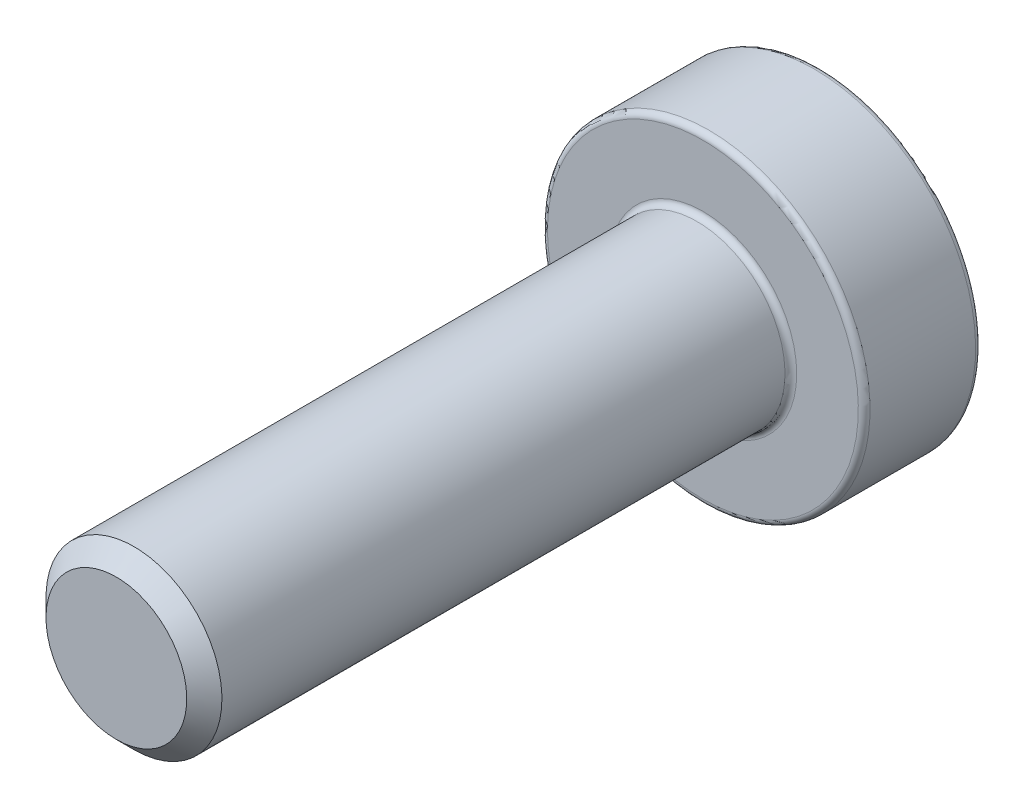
SolidWorks part; units mm, degrees
ref_plane "Plan1" through (0, 0, 0) normal (0, 0, 1) x (1, 0, 0)
ref_plane "Plan2" through (0, 0, 0) normal (0, 1, 0) x (1, 0, 0)
ref_plane "Plan3" through (0, 0, 0) normal (1, 0, 0) x (0, 0, -1)
sketch "Sketch1" plane through (0, 0, 0) normal (1, 0, 0) x (0, 0, -1)
  line L0 (2, 0) -> (-10, 0) construction
  line L1 (-10, 0) -> (-10, 1.5)
  line L2 (-10, 1.5) -> (0, 1.5)
  line L3 (0, 1.5) -> (0, 2.75)
  line L4 (0, 2.75) -> (2, 2.75)
  line L5 (2, 2.75) -> (2, 0)
  line L6 (-10, 0) -> (2, 0)
  line L7 (0, 0) -> (-0.5, 0) construction
  dimension "D" = 3
  dimension "L" = 10
  dimension "K" = 2
  dimension "DK" = 5.5
  dimension "P" = 0.5
revolve "Base-Revolve" add sketch "Sketch1"
fillet "Fillet1" radius 0.1 3 edges at (0, 1.5, 0) (0, 2.75, 0) (0, 2.75, -2)
hole_wizard "Hole1" positions "Sketch4" profile "Sketch3" legacy
sketch "Sketch4" plane through (0, 0, -2) normal (0, 0, -1) x (-1, 0, 0)
  circle A0 centre (0, 0) radius 2.65 construction
  point P0 (0, 0)
sketch "Sketch3" plane through (0, 0, -2) normal (1, 0, 0) x (0, 1, 0)
  line L0 (0, 0) -> (0, 1.4731)
  line L1 (0, 1.4731) -> (1.025, 1.1)
  line L2 (1.025, 1.1) -> (1.025, 0)
  line L4 (1.025, 0) -> (0, 0)
  line L6 (0, 1.4731) -> (-1.025, 1.1) construction
  line L7 (0, -4.2442) -> (0, 117.3081) construction
  dimension "Diameter" = 2.05
  dimension "Depth" = 1.1
  dimension "Drill Angle" = 140
sketch "Sketch5" plane through (0, 0, -2) normal (0, 0, -1) x (-1, 0, 0)
  line L0 (0, 0) -> (0.6, -1.0392) construction
  line L1 (0, 50) -> (0, -50) construction
  line L2 (-1.025, 0) -> (1.025, 0) construction
  arc A0 (1.076, -0.8957) -> (1.3137, -0.484) centre (0, 0) ccw
  arc A1 (1.076, -0.8957) -> (0.2377, -1.3797) centre (0.7875, -1.364) ccw
  arc A3 (-0.2377, -1.3797) -> (-1.076, -0.8957) centre (-0.7875, -1.364) ccw
  arc A4 (-1.3137, -0.484) -> (-1.3137, 0.484) centre (-1.575, 0) ccw
  arc A5 (-1.076, 0.8957) -> (-0.2377, 1.3797) centre (-0.7875, 1.364) ccw
  arc A6 (0.2377, 1.3797) -> (1.076, 0.8957) centre (0.7875, 1.364) ccw
  arc A7 (1.3137, 0.484) -> (1.3137, -0.484) centre (1.575, 0) ccw
  arc A8 (1.3137, 0.484) -> (1.076, 0.8957) centre (0, 0) ccw
  arc A9 (0.2377, 1.3797) -> (-0.2377, 1.3797) centre (0, 0) ccw
  arc A10 (-1.076, 0.8957) -> (-1.3137, 0.484) centre (0, 0) ccw
  arc A11 (-1.3137, -0.484) -> (-1.076, -0.8957) centre (0, 0) ccw
  arc A12 (-0.2377, -1.3797) -> (0.2377, -1.3797) centre (0, 0) ccw
  dimension "D1" = 30
  dimension "AE" = 2.8
  dimension "EE" = 0.55
  dimension "B_E" = 3.15
  dimension "BE" = 2.05
extrude "Cut-Extrude1" cut sketch "Sketch5" against normal blind 1.1
chamfer "Chanfrein1" distance 0.3 angle 45 1 edges at (0, 1.5, 10)
equation "\"D1@Cosmetic_Thread1\" = \"D@Sketch1\"-(1.0825*\"P@Sketch1\")"
equation "\"T@Cut-Extrude1\" = \"Depth@Sketch3\""
equation "\"B_E@Sketch5\" = \"BE@Sketch5\" +  ( 2 * \"EE@Sketch5\" ) "
equation "\"Diameter@Sketch3\" = \"BE@Sketch5\""
